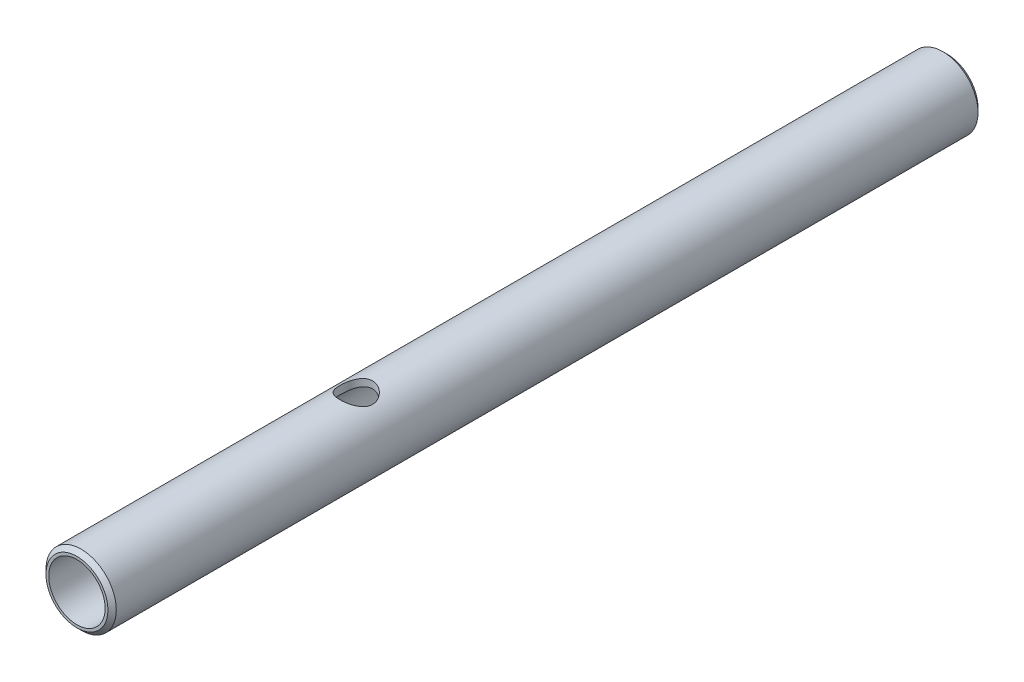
SolidWorks part; units mm, degrees
ref_plane "Front Plane" through (0, 0, 0) normal (0, 0, 1) x (1, 0, 0)
ref_plane "Top Plane" through (0, 0, 0) normal (0, 1, 0) x (1, 0, 0)
ref_plane "Right Plane" through (0, 0, 0) normal (1, 0, 0) x (0, 0, -1)
sketch "Sketch1" plane through (0, 0, 0) normal (0, 0, 1) x (1, 0, 0)
  circle A0 centre (0, 0) radius 10.668
  circle A1 centre (0, 0) radius 8.5598
  dimension "D1" = 21.336
  dimension "D2" = 17.1196
extrude "Boss-Extrude1" add sketch "Sketch1" along normal offset from surface (263.906 mm away) 8.128
chamfer "Chamfer1" distance 1.27 angle 45 2 edges at (10.668, 0, 0) (10.668, 0, 263.906)
sketch "Sketch2" plane through (0, 0, 0) normal (0, 1, 0) x (1, 0, 0)
  circle A0 centre (0, -179.1997) radius 4.9606
  dimension "D1" = 9.9212
extrude "Cut-Extrude1" cut sketch "Sketch2" along normal through all
